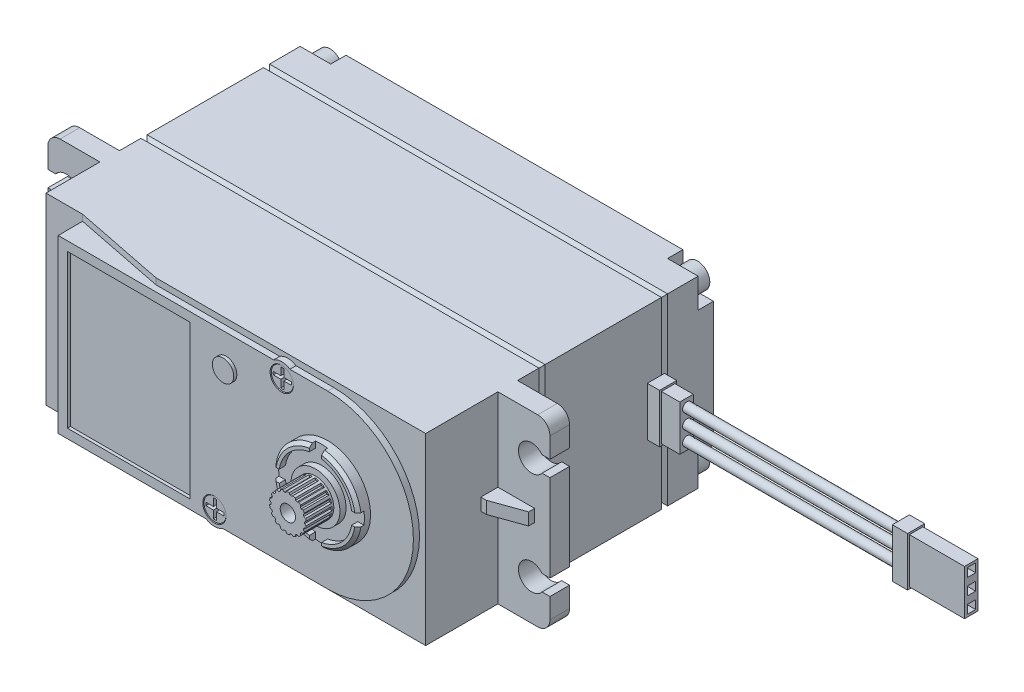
SolidWorks part; units mm, degrees
ref_plane "前视基准面" through (0, 0, 0) normal (0, 0, 1) x (1, 0, 0)
ref_plane "上视基准面" through (0, 0, 0) normal (0, 1, 0) x (1, 0, 0)
ref_plane "右视基准面" through (0, 0, 0) normal (1, 0, 0) x (0, 0, -1)
sketch "草图1" plane through (0, 0, 0) normal (0, 0, 1) x (1, 0, 0)
  line L1 (-32.5, 15) -> (32.5, 15)
  line L2 (-32.5, 15) -> (-32.5, -15)
  line L3 (-32.5, -15) -> (32.5, -15)
  line L4 (32.5, 15) -> (32.5, -15)
  dimension "D1" = 32.5
  dimension "D2" = 65
  dimension "D3" = 15
  dimension "D4" = 30
extrude "凸台-拉伸1" add sketch "草图1" along normal blind 8
chamfer "倒角1" distance 0.5 angle 45 4 edges at (0, 15, 8) (32.5, 0, 8) (0, -15, 8) (-32.5, 0, 8)
sketch "草图2" plane through (0, 0, 8) normal (0, 0, 1) x (1, 0, 0)
  line L0 (32.5, 15) -> (32.5, -15) construction
  line L1 (32.5, -15) -> (-32.5, -15) construction
  line L2 (-32.5, -15) -> (-32.5, 15) construction
  line L3 (-32.5, 15) -> (32.5, 15) construction
  line L4 (32.5, 15) -> (32.5, -15)
  line L5 (32.5, -15) -> (-32.5, -15)
  line L6 (-32.5, -15) -> (-32.5, 15)
  line L7 (-32.5, 15) -> (32.5, 15)
extrude "凸台-拉伸2" add sketch "草图2" along normal blind 20
chamfer "倒角2" distance 0.5 angle 45 4 edges at (32.5, 0, 28) (0, -15, 28) (-32.5, 0, 28) (0, 15, 28)
sketch "草图3" plane through (0, 0, 28) normal (0, 0, 1) x (1, 0, 0)
  line L0 (32.5, 15) -> (32.5, -15) construction
  line L1 (32.5, -15) -> (-32.5, -15) construction
  line L2 (-32.5, -15) -> (-32.5, 15) construction
  line L3 (-32.5, 15) -> (32.5, 15) construction
  line L4 (32.5, 15) -> (32.5, -15)
  line L5 (32.5, -15) -> (-32.5, -15)
  line L6 (-32.5, -15) -> (-32.5, 15)
  line L7 (-32.5, 15) -> (32.5, 15)
extrude "凸台-拉伸3" add sketch "草图3" along normal blind 20
chamfer "倒角3" distance 0.5 angle 45 8 edges at (-32.5, 0, 28) (0, -15, 28) (0, 15, 28) (32.5, 0, 28) (32.5, 0, 8) (0, 15, 8) (-32.5, 0, 8) (0, -15, 8)
sketch "草图4" plane through (0, 0, 48) normal (0, 0, 1) x (1, 0, 0)
  line L0 (32.5, -15) -> (32.5, 15) construction
  circle A0 centre (17.5, 0) radius 7
  dimension "D1" = 15
  dimension "D2" = 14
extrude "凸台-拉伸4" add sketch "草图4" along normal blind 2
sketch "草图5" plane through (0, 0, 50) normal (0, 0, 1) x (1, 0, 0)
  circle A0 centre (17.5, 0) radius 3
  dimension "D1" = 6
extrude "凸台-拉伸5" add sketch "草图5" along normal blind 4.5
sketch "草图6" plane through (0, 0, 54.5) normal (0, 0, 1) x (1, 0, 0)
  circle A0 centre (17.5, 0) radius 1.25
  dimension "D1" = 2.5
extrude "切除-拉伸1" cut sketch "草图6" against normal blind 5
sketch "草图7" plane through (0, 0, 50) normal (0, 0, 1) x (1, 0, 0)
  circle A0 centre (17.5, 0) radius 4
  circle A1 centre (17.5, 0) radius 6
  dimension "D1" = 12
  dimension "D2" = 8
extrude "切除-拉伸2" cut sketch "草图7" against normal blind 1
sketch "草图8" plane through (0, 0, 50) normal (0, 0, 1) x (1, 0, 0)
  line L0 (18.5, -6.9282) -> (18.5, -5.9161)
  line L1 (24.4282, -1) -> (23.4161, -1)
  line L2 (10.5718, -1) -> (11.5839, -1)
  line L3 (18.5, 6.9282) -> (18.5, 5.9161)
  line L4 (16.5, -6.9282) -> (16.5, -5.9161)
  line L5 (24.4282, 1) -> (23.4161, 1)
  line L6 (16.5, 6.9282) -> (16.5, 5.9161)
  line L7 (10.5718, 1) -> (11.5839, 1)
  line L8 (10.5, 0) -> (24.5, 0) construction
  circle A1 centre (17.5, 0) radius 7 construction
  circle A11 centre (17.5, 0) radius 7 construction
  circle A14 centre (17.5, 0) radius 6 construction
  arc A15 (11.5839, 1) -> (11.5839, -1) centre (17.5, 0) ccw
  arc A16 (10.5718, 1) -> (10.5718, -1) centre (17.5, 0) ccw
  arc A17 (18.5, 6.9282) -> (16.5, 6.9282) centre (17.5, 0) ccw
  arc A18 (18.5, 5.9161) -> (16.5, 5.9161) centre (17.5, 0) ccw
  arc A19 (24.4282, -1) -> (24.4282, 1) centre (17.5, 0) ccw
  arc A20 (23.4161, -1) -> (23.4161, 1) centre (17.5, 0) ccw
  arc A21 (16.5, -5.9161) -> (18.5, -5.9161) centre (17.5, 0) ccw
  arc A22 (16.5, -6.9282) -> (18.5, -6.9282) centre (17.5, 0) ccw
  point P12 (21.5, 7)
  point P13 (21.5, -7.2442)
  point P16 (23.5, 7)
  point P17 (23.5, -7.2442)
  point P29 (17.5, 0)
  dimension "D2" = 1
  dimension "D3" = 1
  dimension "D4" = 1
  dimension "D5" = 1
  dimension "D1" = 4
extrude "切除-拉伸3" cut sketch "草图8" against normal blind 1
chamfer "倒角4" distance 0.5 angle 45 4 edges at (22.4497, 4.9497, 50) (22.4497, -4.9497, 50) (12.5503, -4.9497, 50) (12.5503, 4.9497, 50)
sketch "草图9" plane through (0, 0, 54.5) normal (0, 0, 1) x (1, 0, 0)
  line L0 (18.1005, 2.6732) -> (18.3385, 2.8804)
  line L58 (17.15, 2.7174) -> (17.3027, 2.9935)
  line L92 (16.8995, 2.6732) -> (16.6615, 2.8804)
  line L94 (17.85, 2.7174) -> (17.6973, 2.9935)
  line L96 (18.9786, 2.3066) -> (19.2731, 2.42)
  line L98 (18.7583, 2.4338) -> (18.7092, 2.7455)
  line L100 (19.6783, 1.6618) -> (19.9938, 1.6676)
  line L102 (19.5148, 1.8567) -> (19.5753, 2.1664)
  line L104 (20.1153, 0.8166) -> (20.4138, 0.7141)
  line L106 (20.0283, 1.0556) -> (20.1911, 1.3259)
  line L108 (20.2369, -0.1272) -> (20.4823, -0.3256)
  line L110 (20.2369, 0.1272) -> (20.4823, 0.3256)
  line L112 (20.0283, -1.0556) -> (20.1911, -1.3259)
  line L114 (20.1153, -0.8166) -> (20.4138, -0.7141)
  line L116 (19.5148, -1.8567) -> (19.5753, -2.1664)
  line L118 (19.6783, -1.6618) -> (19.9938, -1.6676)
  line L120 (18.7583, -2.4338) -> (18.7092, -2.7455)
  line L122 (18.9786, -2.3066) -> (19.2731, -2.42)
  line L123 (17.85, -2.7174) -> (17.6973, -2.9935)
  line L124 (18.1005, -2.6732) -> (18.3385, -2.8804)
  line L125 (16.8995, -2.6732) -> (16.6615, -2.8804)
  line L126 (17.15, -2.7174) -> (17.3027, -2.9935)
  line L127 (16.0214, -2.3066) -> (15.7269, -2.42)
  line L128 (16.2417, -2.4338) -> (16.2908, -2.7455)
  line L129 (15.3217, -1.6618) -> (15.0062, -1.6676)
  line L130 (15.4852, -1.8567) -> (15.4247, -2.1664)
  line L131 (14.8847, -0.8166) -> (14.5862, -0.7141)
  line L132 (14.9717, -1.0556) -> (14.8089, -1.3259)
  line L133 (14.7631, 0.1272) -> (14.5177, 0.3256)
  line L134 (14.7631, -0.1272) -> (14.5177, -0.3256)
  line L135 (14.9717, 1.0556) -> (14.8089, 1.3259)
  line L136 (14.8847, 0.8166) -> (14.5862, 0.7141)
  line L137 (15.4852, 1.8567) -> (15.4247, 2.1664)
  line L138 (15.3217, 1.6618) -> (15.0062, 1.6676)
  line L139 (16.2417, 2.4338) -> (16.2908, 2.7455)
  line L140 (16.0214, 2.3066) -> (15.7269, 2.42)
  arc A53 (17.15, 2.7174) -> (16.8995, 2.6732) centre (17.5, 0) ccw
  arc A86 (18.3385, 2.8804) -> (17.6973, 2.9935) centre (17.5, 0) ccw
  circle A88 centre (17.5, 0) radius 3 construction
  arc A89 (17.3027, 2.9935) -> (16.6615, 2.8804) centre (17.5, 0) ccw
  arc A90 (18.1005, 2.6732) -> (17.85, 2.7174) centre (17.5, 0) ccw
  arc A91 (19.2731, 2.42) -> (18.7092, 2.7455) centre (17.5, 0) ccw
  arc A92 (18.9786, 2.3066) -> (18.7583, 2.4338) centre (17.5, 0) ccw
  arc A93 (19.9938, 1.6676) -> (19.5753, 2.1664) centre (17.5, 0) ccw
  arc A94 (19.6783, 1.6618) -> (19.5148, 1.8567) centre (17.5, 0) ccw
  arc A95 (20.4138, 0.7141) -> (20.1911, 1.3259) centre (17.5, 0) ccw
  arc A96 (20.1153, 0.8166) -> (20.0283, 1.0556) centre (17.5, 0) ccw
  arc A97 (20.4823, -0.3256) -> (20.4823, 0.3256) centre (17.5, 0) ccw
  arc A98 (20.2369, -0.1272) -> (20.2369, 0.1272) centre (17.5, 0) ccw
  arc A99 (20.1911, -1.3259) -> (20.4138, -0.7141) centre (17.5, 0) ccw
  arc A100 (20.0283, -1.0556) -> (20.1153, -0.8166) centre (17.5, 0) ccw
  arc A101 (19.5753, -2.1664) -> (19.9938, -1.6676) centre (17.5, 0) ccw
  arc A102 (19.5148, -1.8567) -> (19.6783, -1.6618) centre (17.5, 0) ccw
  arc A103 (18.7092, -2.7455) -> (19.2731, -2.42) centre (17.5, 0) ccw
  arc A104 (18.7583, -2.4338) -> (18.9786, -2.3066) centre (17.5, 0) ccw
  arc A105 (17.6973, -2.9935) -> (18.3385, -2.8804) centre (17.5, 0) ccw
  arc A106 (17.85, -2.7174) -> (18.1005, -2.6732) centre (17.5, 0) ccw
  arc A107 (16.6615, -2.8804) -> (17.3027, -2.9935) centre (17.5, 0) ccw
  arc A108 (16.8995, -2.6732) -> (17.15, -2.7174) centre (17.5, 0) ccw
  arc A109 (15.7269, -2.42) -> (16.2908, -2.7455) centre (17.5, 0) ccw
  arc A110 (16.0214, -2.3066) -> (16.2417, -2.4338) centre (17.5, 0) ccw
  arc A111 (15.0062, -1.6676) -> (15.4247, -2.1664) centre (17.5, 0) ccw
  arc A112 (15.3217, -1.6618) -> (15.4852, -1.8567) centre (17.5, 0) ccw
  arc A113 (14.5862, -0.7141) -> (14.8089, -1.3259) centre (17.5, 0) ccw
  arc A114 (14.8847, -0.8166) -> (14.9717, -1.0556) centre (17.5, 0) ccw
  arc A115 (14.5177, 0.3256) -> (14.5177, -0.3256) centre (17.5, 0) ccw
  arc A116 (14.7631, 0.1272) -> (14.7631, -0.1272) centre (17.5, 0) ccw
  arc A117 (14.8089, 1.3259) -> (14.5862, 0.7141) centre (17.5, 0) ccw
  arc A118 (14.9717, 1.0556) -> (14.8847, 0.8166) centre (17.5, 0) ccw
  arc A119 (15.4247, 2.1664) -> (15.0062, 1.6676) centre (17.5, 0) ccw
  arc A120 (15.4852, 1.8567) -> (15.3217, 1.6618) centre (17.5, 0) ccw
  arc A121 (16.2908, 2.7455) -> (15.7269, 2.42) centre (17.5, 0) ccw
  arc A122 (16.2417, 2.4338) -> (16.0214, 2.3066) centre (17.5, 0) ccw
  point P76 (17.5, 0)
extrude "切除-拉伸4" cut sketch "草图9" against normal blind 4.2
ref_plane "基准面1" through (0, 0, 32) normal (0, 0, -1) x (-1, 0, 0)
sketch "草图10" plane through (0, 0, 32) normal (0, 0, -1) x (-1, 0, 0)
  line L2 (41, -9.7) -> (41, -15)
  line L3 (-32.5, -15) -> (-32.5, 15) construction
  line L4 (-41, 15) -> (-41, 9.7)
  line L5 (41, 7.1) -> (41, -7.1)
  line L6 (-32.5, 15) -> (-41, 15)
  line L7 (-32.5, -15) -> (-41, -15)
  line L8 (-32.5, -15) -> (-32.5, 15)
  line L10 (-39.7125, 9.7) -> (-41, 9.7)
  line L11 (-39.7125, 7.1) -> (-41, 7.1)
  line L12 (-39.7125, -7.1) -> (-41, -7.1)
  line L13 (-39.7125, -9.7) -> (-41, -9.7)
  line L14 (-41, 7.1) -> (-41, -7.1)
  line L15 (-41, -9.7) -> (-41, -15)
  line L16 (39.7125, -9.7) -> (41, -9.7)
  line L17 (39.7125, -7.1) -> (41, -7.1)
  line L18 (39.7125, 7.1) -> (41, 7.1)
  line L19 (39.7125, 9.7) -> (41, 9.7)
  line L20 (32.5, -15) -> (32.5, 15)
  line L21 (32.5, -15) -> (41, -15)
  line L22 (32.5, 15) -> (41, 15)
  line L23 (41, 15) -> (41, 9.7)
  arc A0 (-39.7125, 7.1) -> (-39.7125, 9.7) centre (-38, 8.4) ccw
  arc A1 (-39.7125, -7.1) -> (-39.7125, -9.7) centre (-38, -8.4) cw
  arc A2 (39.7125, -7.1) -> (39.7125, -9.7) centre (38, -8.4) ccw
  arc A3 (39.7125, 7.1) -> (39.7125, 9.7) centre (38, 8.4) cw
  point P10 (-41, -23.8015)
  dimension "D4" = 4.3
extrude "凸台-拉伸6" add sketch "草图10" against normal blind 3.2
sketch "草图11" plane through (0, 0, 35.2) normal (0, 0, 1) x (1, 0, 0)
  line L2 (-38.5, -0.4932) -> (-32.5, -0.4932)
  line L3 (-38.5, 1.5068) -> (-32.5, 1.5068)
  line L4 (-32.5, 15) -> (-32.5, -15) construction
  line L5 (-32.5, 1.5068) -> (-32.5, -0.4932)
  line L6 (-38.5, 1.5068) -> (-38.5, -0.4932)
  line L8 (38.5, 1.5068) -> (38.5, -0.4932)
  line L9 (32.5, 1.5068) -> (32.5, -0.4932)
  line L10 (-32.5, 15) -> (-32.5, -15) construction
  line L11 (-38.5, 15) -> (-38.5, -15) construction
  line L12 (38.5, 1.5068) -> (32.5, 1.5068)
  line L13 (38.5, -0.4932) -> (32.5, -0.4932)
  point P4 (-41, -0.4932)
  point P5 (-31.3402, -0.4932)
  point P6 (-41, 1.5068)
  point P7 (-31.3402, 1.5068)
  dimension "D3" = 6
extrude "凸台-拉伸7" add sketch "草图11" along normal blind 2.8
sketch "草图12" plane through (0, -0.4932, 0) normal (0, -1, 0) x (1, 0, 0)
  line L0 (-38.5, 36.1787) -> (-33.4098, 38)
  line L1 (-38.5, 38) -> (-38.5, 35.2) construction
  line L2 (-33.4098, 38) -> (-38.5, 38)
  line L3 (-38.5, 38) -> (-38.5, 36.1787)
  line L6 (38.5, 38) -> (38.5, 36.1787)
  line L7 (33.4098, 38) -> (38.5, 38)
  line L8 (38.5, 36.1787) -> (33.4098, 38)
extrude "切除-拉伸5" cut sketch "草图12" against normal blind 2.8
sketch "草图15" plane through (0, 0, 48) normal (0, 0, 1) x (1, 0, 0)
  line L0 (17.5, 14) -> (-26.5, 14)
  line L1 (17.5, -14) -> (-26.5, -14)
  line L2 (-26.5, 14) -> (-26.5, -14)
  line L3 (-32.5, 15) -> (-32.5, -15) construction
  line L4 (-32.5, 15) -> (32.5, 15)
  line L5 (32.5, 15) -> (32.5, -15)
  line L6 (32.5, -15) -> (-32.5, -15)
  line L7 (-32.5, -15) -> (-32.5, 15)
  arc A1 (17.5, -14) -> (17.5, 14) centre (17.5, 0) ccw
  dimension "D1" = 28
  dimension "D2" = 6
extrude "切除-拉伸6" cut sketch "草图15" against normal blind 1
sketch "草图16" plane through (0, 0, 47) normal (0, 0, 1) x (1, 0, 0)
  line L0 (-32.5, -15) -> (32.5, -15) construction
  line L1 (-32.5, 15) -> (-26.5251, 15)
  line L2 (-32.5, 15) -> (-32.5, -15)
  line L3 (-32.5, -15) -> (-26.5251, -15)
  line L4 (-26.5251, 15) -> (-26.5251, -15)
extrude "切除-拉伸7" cut sketch "草图16" against normal blind 3
sketch "草图17" plane through (0, -15, 0) normal (0, -1, 0) x (1, 0, 0)
  line L0 (-26.5251, 44) -> (-11.5251, 47)
  line L1 (-26.5251, 47) -> (32.5, 47) construction
  line L2 (-11.5251, 47) -> (-26.5251, 47)
  line L3 (-26.5251, 47) -> (-26.5251, 44)
  dimension "D1" = 15
extrude "切除-拉伸8" cut sketch "草图17" against normal blind 1
mirror "镜向1" about plane through (0, 0, 0) normal (0, 1, 0) of "切除-拉伸8"
sketch "草图18" plane through (0, 0, 48) normal (0, 0, 1) x (1, 0, 0)
  line L0 (-26.5, 14) -> (-26.5, -14) construction
  line L1 (-25, 12.5) -> (-5, 12.5)
  line L2 (-25, 12.5) -> (-25, -12.5)
  line L3 (-25, -12.5) -> (-5, -12.5)
  line L4 (-5, 12.5) -> (-5, -12.5)
  line L5 (-26.5251, 14) -> (-11.5251, 14) construction
  line L6 (-26.5, -14) -> (17.5, -14) construction
  dimension "D1" = 20
  dimension "D2" = 1.5
  dimension "D3" = 1.5
  dimension "D4" = 1.5
extrude "切除-拉伸9" cut sketch "草图18" against normal blind 0.5
sketch "草图19" plane through (0, 0, 48) normal (0, 0, 1) x (1, 0, 0)
  circle A0 centre (0.9122, 8.8935) radius 1.75
  dimension "D1" = 3.5
extrude "凸台-拉伸8" add sketch "草图19" along normal blind 0.5
sketch "草图21" plane through (0, 0, 47) normal (0, 0, 1) x (1, 0, 0)
  line L0 (32.5, 15) -> (-11.5251, 15) construction
  line L1 (-11.5251, -15) -> (32.5, -15) construction
  circle A0 centre (10, 12) radius 2.4
  circle A1 centre (-1, -12) radius 2.4
  dimension "D1" = 4.8
  dimension "D2" = 3
  dimension "D3" = 10
  dimension "D4" = 4.8
  dimension "D5" = 3
  dimension "D6" = 1
extrude "凸台-拉伸9" add sketch "草图21" along normal blind 1
sketch "草图22" plane through (0, 0, 48) normal (0, 0, 1) x (1, 0, 0)
  circle A0 centre (-1, -12) radius 1.9
  circle A1 centre (10, 12) radius 1.9
  dimension "D1" = 3.8
  dimension "D2" = 3.8
extrude "切除-拉伸11" cut sketch "草图22" against normal blind 1.4
sketch "草图23" plane through (0, 0, 46.6) normal (0, 0, 1) x (1, 0, 0)
  line L6 (10.25, 11.75) -> (10.25, 10.521)
  line L7 (10.25, 12.25) -> (11.479, 12.25)
  line L9 (9.75, 11.75) -> (9.75, 10.521)
  line L11 (10.25, 11.75) -> (11.479, 11.75)
  line L14 (-1.25, -12.25) -> (-1.25, -13.479)
  line L15 (-0.75, -11.75) -> (0.479, -11.75)
  line L16 (9.75, 13.479) -> (9.75, 12.25)
  line L17 (10.25, 13.479) -> (10.25, 12.25)
  line L18 (8.521, 12.25) -> (9.75, 12.25)
  line L19 (8.521, 11.75) -> (9.75, 11.75)
  line L21 (-0.75, -12.25) -> (-0.75, -13.479)
  line L23 (-0.75, -12.25) -> (0.479, -12.25)
  line L27 (-0.75, -10.521) -> (-0.75, -11.75)
  line L28 (-1.25, -10.521) -> (-1.25, -11.75)
  line L29 (-2.479, -11.75) -> (-1.25, -11.75)
  line L30 (-2.479, -12.25) -> (-1.25, -12.25)
  circle A0 centre (10, 12) radius 1.8
  arc A1 (10.25, 13.479) -> (9.75, 13.479) centre (10, 12) ccw
  arc A2 (8.521, 12.25) -> (8.521, 11.75) centre (10, 12) ccw
  arc A3 (9.75, 10.521) -> (10.25, 10.521) centre (10, 12) ccw
  arc A4 (11.479, 11.75) -> (11.479, 12.25) centre (10, 12) ccw
  circle A5 centre (-1, -12) radius 1.8
  arc A6 (0.479, -12.25) -> (0.479, -11.75) centre (-1, -12) ccw
  arc A9 (-0.75, -10.521) -> (-1.25, -10.521) centre (-1, -12) ccw
  arc A10 (-2.479, -11.75) -> (-2.479, -12.25) centre (-1, -12) ccw
  arc A11 (-1.25, -13.479) -> (-0.75, -13.479) centre (-1, -12) ccw
  point P8 (8.2, 11.75)
  point P9 (12.0905, 11.75)
  point P10 (9.75, 13.8)
  point P11 (9.75, 9.8425)
  point P12 (8.2, 12.25)
  point P13 (12.0905, 12.25)
  point P14 (10.25, 13.8)
  point P15 (10.25, 9.8425)
  point P39 (-2.8, -12.25)
  point P40 (1.2543, -12.25)
  point P41 (-1.25, -10.1)
  point P42 (-1.25, -14.0125)
  point P43 (-2.8, -11.75)
  point P44 (1.2543, -11.75)
  point P45 (-0.75, -10.1)
  point P46 (-0.75, -14.0125)
  dimension "D1" = 3.6
  dimension "D2" = 3
  dimension "D3" = 3.6
  dimension "D4" = 3
extrude "凸台-拉伸10" add sketch "草图23" along normal blind 1.3
sketch "草图24" plane through (0, 0, 0) normal (0, 0, -1) x (-1, 0, 0)
  line L4 (-27.5, 12.7029) -> (-27.5, 15)
  line L5 (-30, 10.2029) -> (-32.5, 10.2029)
  line L6 (-32.5, 10.2029) -> (-32.5, 15)
  line L9 (-27.5, 15) -> (-32.5, 15)
  line L11 (-27.5, -15) -> (-32.5, -15)
  line L12 (-32.5, -10.2029) -> (-32.5, -15)
  line L13 (-30, -10.2029) -> (-32.5, -10.2029)
  line L14 (-27.5, -12.7029) -> (-27.5, -15)
  line L15 (27.5, -12.7029) -> (27.5, -15)
  line L16 (30, -10.2029) -> (32.5, -10.2029)
  line L17 (32.5, -10.2029) -> (32.5, -15)
  line L18 (27.5, -15) -> (32.5, -15)
  line L19 (27.5, 15) -> (32.5, 15)
  line L20 (32.5, 10.2029) -> (32.5, 15)
  line L21 (30, 10.2029) -> (32.5, 10.2029)
  line L22 (27.5, 12.7029) -> (27.5, 15)
  arc A0 (-30, 10.2029) -> (-27.5, 12.7029) centre (-30, 12.7029) ccw
  arc A1 (-30, -10.2029) -> (-27.5, -12.7029) centre (-30, -12.7029) cw
  arc A2 (30, -10.2029) -> (27.5, -12.7029) centre (30, -12.7029) ccw
  arc A3 (30, 10.2029) -> (27.5, 12.7029) centre (30, 12.7029) cw
  dimension "D1" = 5
extrude "切除-拉伸12" cut sketch "草图24" against normal blind 2.5
sketch "草图25" plane through (0, 0, 2.5) normal (0, 0, -1) x (-1, 0, 0)
  line L0 (-29.7, 13.0029) -> (-28.2252, 13.0029)
  line L1 (-30.3, 12.4029) -> (-30.3, 10.928)
  line L2 (-29.7, 12.4029) -> (-29.7, 10.928)
  line L3 (-29.7, 12.4029) -> (-28.2252, 12.4029)
  line L6 (-29.7, 14.4777) -> (-29.7, 13.0029)
  line L7 (-30.3, 14.4777) -> (-30.3, 13.0029)
  line L8 (-31.7748, -13.0029) -> (-30.3, -13.0029)
  line L9 (-31.7748, -12.4029) -> (-30.3, -12.4029)
  line L10 (-30.3, -14.4777) -> (-30.3, -13.0029)
  line L11 (-31.7748, 12.4029) -> (-30.3, 12.4029)
  line L12 (-29.7, -14.4777) -> (-29.7, -13.0029)
  line L13 (-31.7748, 13.0029) -> (-30.3, 13.0029)
  line L14 (-29.7, -12.4029) -> (-28.2252, -12.4029)
  line L15 (-29.7, -12.4029) -> (-29.7, -10.928)
  line L16 (-30.3, -12.4029) -> (-30.3, -10.928)
  line L17 (-29.7, -13.0029) -> (-28.2252, -13.0029)
  line L20 (29.7, -13.0029) -> (28.2252, -13.0029)
  line L21 (30.3, -12.4029) -> (30.3, -10.928)
  line L22 (29.7, -12.4029) -> (29.7, -10.928)
  line L23 (29.7, -12.4029) -> (28.2252, -12.4029)
  line L24 (29.7, -14.4777) -> (29.7, -13.0029)
  line L25 (30.3, -14.4777) -> (30.3, -13.0029)
  line L26 (31.7748, -12.4029) -> (30.3, -12.4029)
  line L27 (31.7748, -13.0029) -> (30.3, -13.0029)
  line L28 (31.7748, 13.0029) -> (30.3, 13.0029)
  line L29 (31.7748, 12.4029) -> (30.3, 12.4029)
  line L30 (30.3, 14.4777) -> (30.3, 13.0029)
  line L31 (29.7, 14.4777) -> (29.7, 13.0029)
  line L32 (29.7, 12.4029) -> (28.2252, 12.4029)
  line L33 (29.7, 12.4029) -> (29.7, 10.928)
  line L34 (30.3, 12.4029) -> (30.3, 10.928)
  line L35 (29.7, 13.0029) -> (28.2252, 13.0029)
  circle A0 centre (-30, 12.7029) radius 2
  arc A1 (-29.7, 14.4777) -> (-30.3, 14.4777) centre (-30, 12.7029) ccw
  arc A2 (-31.7748, 13.0029) -> (-31.7748, 12.4029) centre (-30, 12.7029) ccw
  arc A3 (-30.3, 10.928) -> (-29.7, 10.928) centre (-30, 12.7029) ccw
  arc A4 (-28.2252, 12.4029) -> (-28.2252, 13.0029) centre (-30, 12.7029) ccw
  arc A5 (-28.2252, -12.4029) -> (-28.2252, -13.0029) centre (-30, -12.7029) cw
  arc A6 (-30.3, -10.928) -> (-29.7, -10.928) centre (-30, -12.7029) cw
  arc A7 (-31.7748, -13.0029) -> (-31.7748, -12.4029) centre (-30, -12.7029) cw
  arc A8 (-29.7, -14.4777) -> (-30.3, -14.4777) centre (-30, -12.7029) cw
  circle A9 centre (-30, -12.7029) radius 2
  circle A10 centre (30, -12.7029) radius 2
  arc A11 (29.7, -14.4777) -> (30.3, -14.4777) centre (30, -12.7029) ccw
  arc A12 (31.7748, -13.0029) -> (31.7748, -12.4029) centre (30, -12.7029) ccw
  arc A13 (30.3, -10.928) -> (29.7, -10.928) centre (30, -12.7029) ccw
  arc A14 (28.2252, -12.4029) -> (28.2252, -13.0029) centre (30, -12.7029) ccw
  arc A15 (28.2252, 12.4029) -> (28.2252, 13.0029) centre (30, 12.7029) cw
  arc A16 (30.3, 10.928) -> (29.7, 10.928) centre (30, 12.7029) cw
  arc A17 (31.7748, 13.0029) -> (31.7748, 12.4029) centre (30, 12.7029) cw
  arc A18 (29.7, 14.4777) -> (30.3, 14.4777) centre (30, 12.7029) cw
  circle A19 centre (30, 12.7029) radius 2
  point P8 (-32, 12.4029)
  point P9 (-27.7989, 12.4029)
  point P10 (-30.3, 14.7029)
  point P11 (-30.3, 10.7029)
  point P12 (-32, 13.0029)
  point P13 (-27.7989, 13.0029)
  point P14 (-29.7, 14.7029)
  point P15 (-29.7, 10.7029)
  dimension "D1" = 4
  dimension "D2" = 3.6
extrude "凸台-拉伸11" add sketch "草图25" along normal blind 2.4
sketch "草图26" plane through (32.5, 0, 0) normal (1, 0, 0) x (0, 0, -1)
  line L0 (-8, -14.5) -> (-8, 14.5) construction
  line L2 (-10.8, 4) -> (-8, 4)
  line L3 (-10.8, 4) -> (-10.8, -4)
  line L4 (-10.8, -4) -> (-8, -4)
  line L5 (-8, 4) -> (-8, -4)
  dimension "D1" = 2.8
  dimension "D2" = 8
  dimension "D4" = 0
extrude "凸台-拉伸12" add sketch "草图26" along normal blind 2
sketch "草图27" plane through (34.5, 0, 0) normal (1, 0, 0) x (0, 0, -1)
  line L16 (-10.5, 3.7) -> (-10.5, -3.7)
  line L17 (-10.5, -3.7) -> (-8.3, -3.7)
  line L18 (-8.3, -3.7) -> (-8.3, 3.7)
  line L19 (-8.3, 3.7) -> (-10.5, 3.7)
  line L20 (-10.5, 3.7) -> (-10.5, -3.7)
  line L21 (-10.5, -3.7) -> (-8.3, -3.7)
  line L22 (-8.3, -3.7) -> (-8.3, 3.7)
  line L23 (-8.3, 3.7) -> (-10.5, 3.7)
  dimension "D2" = 0.3
extrude "凸台-拉伸13" add sketch "草图27" along normal blind 3
sketch "草图28" plane through (37.5, 0, 0) normal (1, 0, 0) x (0, 0, -1)
  line L0 (-8.3, 3.7) -> (-10.5, 3.7) construction
  line L1 (-8.3, -3.7) -> (-8.3, 3.7) construction
  circle A0 centre (-9.3, 0) radius 0.75
  circle A1 centre (-9.3, 2.4) radius 0.75
  circle A2 centre (-9.3, -2.4) radius 0.75
  dimension "D1" = 1.5
  dimension "D2" = 1.5
  dimension "D3" = 1.5
  dimension "D4" = 1.3
  dimension "D5" = 2.4
  dimension "D6" = 2.4
  dimension "D7" = 1
extrude "凸台-拉伸14" add sketch "草图28" along normal blind 35
sketch "草图29" plane through (72.5, 0, 0) normal (1, 0, 0) x (0, 0, -1)
  line L0 (-8, -14.5) -> (-8, 14.5) construction
  line L1 (-10.8, 4) -> (-8, 4)
  line L2 (-10.8, 4) -> (-10.8, -4)
  line L3 (-10.8, -4) -> (-8, -4)
  line L4 (-8, 4) -> (-8, -4)
  line L5 (-10.8, -4) -> (-8, -4) construction
extrude "凸台-拉伸15" add sketch "草图29" along normal blind 2.5
sketch "草图30" plane through (75, 0, 0) normal (1, 0, 0) x (0, 0, -1)
  line L5 (-10.0126, 3.3) -> (-8.6871, 3.3)
  line L6 (-10.0126, 3.3) -> (-10.0126, 1.9)
  line L7 (-10.0126, 1.9) -> (-8.6871, 1.9)
  line L16 (-10.5, 3.7) -> (-10.5, -3.7)
  line L17 (-10.5, -3.7) -> (-8.3, -3.7)
  line L18 (-8.3, -3.7) -> (-8.3, 3.7)
  line L19 (-8.3, 3.7) -> (-10.5, 3.7)
  line L20 (-10.5, 3.7) -> (-10.5, -3.7)
  line L21 (-10.5, -3.7) -> (-8.3, -3.7)
  line L22 (-8.3, -3.7) -> (-8.3, 3.7)
  line L23 (-8.3, 3.7) -> (-10.5, 3.7)
  line L24 (-8.6871, 3.3) -> (-8.6871, 1.9)
  line L25 (-10.0126, 0.7) -> (-8.6871, 0.7)
  line L26 (-10.0126, 0.7) -> (-10.0126, -0.7)
  line L27 (-10.0126, -0.7) -> (-8.6871, -0.7)
  line L28 (-8.6871, 0.7) -> (-8.6871, -0.7)
  line L29 (-10.0126, -1.9) -> (-8.6871, -1.9)
  line L30 (-10.0126, -1.9) -> (-10.0126, -3.3)
  line L31 (-10.0126, -3.3) -> (-8.6871, -3.3)
  line L32 (-8.6871, -1.9) -> (-8.6871, -3.3)
  point P16 (-9.4, 3.7)
  dimension "D1" = 1.4
  dimension "D3" = 1.4
  dimension "D4" = 1.4
  dimension "D5" = 0.4
  dimension "D6" = 1.2
  dimension "D7" = 1.2
  dimension "D2" = 0.3
extrude "凸台-拉伸16" add sketch "草图30" along normal blind 9
fillet "圆角1" radius 2 4 edges at (41, 15, 33.6) (41, -15, 33.6) (-41, 15, 33.6) (-41, -15, 33.6)
